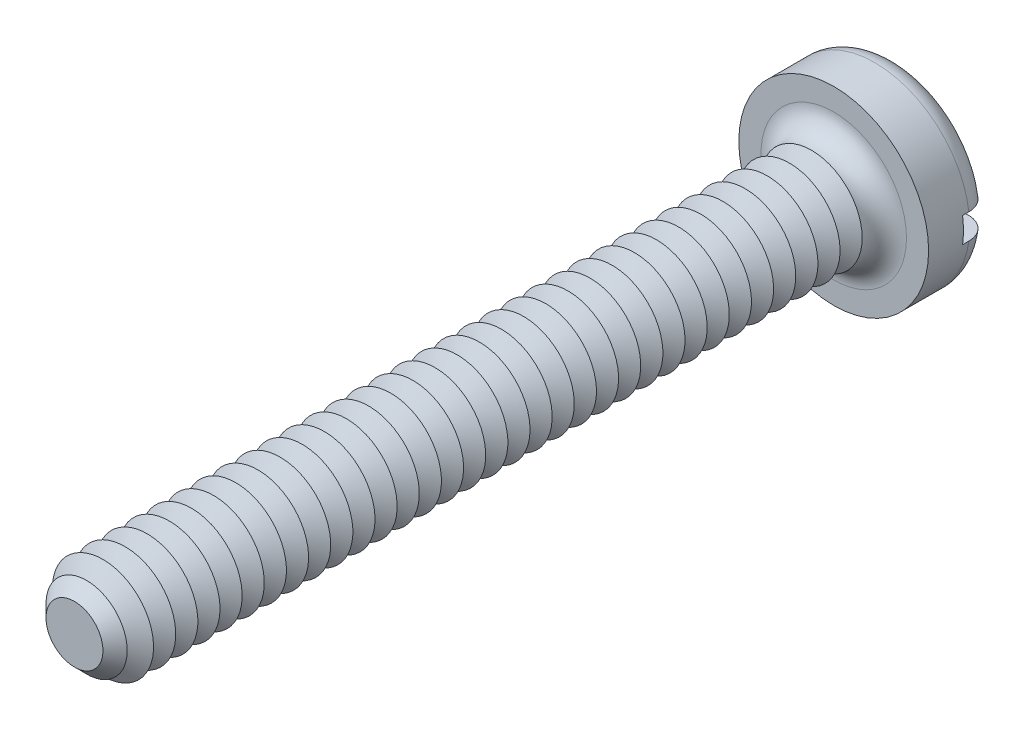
SolidWorks part; units mm, degrees
ref_plane "Front Plane" through (0, 0, 0) normal (0, 0, 1) x (1, 0, 0)
ref_plane "Top Plane" through (0, 0, 0) normal (0, 1, 0) x (1, 0, 0)
ref_plane "Right Plane" through (0, 0, 0) normal (1, 0, 0) x (0, 0, -1)
sketch "Sketch3" plane through (0, 0, 0) normal (0, 0, 1) x (1, 0, 0)
  circle A0 centre (0, 0) radius 1.5
  dimension "D1" = 3
extrude "Boss-Extrude2" add sketch "Sketch3" against normal blind 1
sketch "Sketch4" plane through (0, 0, 0) normal (0, 0, 1) x (1, 0, 0)
  circle A0 centre (0, 0) radius 0.8
  dimension "D1" = 1.6
extrude "Boss-Extrude3" add sketch "Sketch4" along normal blind 12
fillet "Fillet1" radius 0.35 2 edges at (1.5, 0, -1) (0.8, 0, 0)
chamfer "Chamfer1" distance 0.35 angle 45 1 edges at (0.8, 0, 12)
sketch "Sketch5" plane through (0, 0, 0) normal (1, 0, 0) x (0, 0, -1)
  line L0 (1.6944, 0) -> (-7.6738, 0) construction
sketch "Sketch6" plane through (0, 0, 0) normal (1, 0, 0) x (0, 0, -1)
  line L0 (-0.35, 0.8) -> (-0.525, 0.4969)
  line L1 (-0.525, 0.4969) -> (-0.7, 0.8)
  line L2 (-0.35, 0.8) -> (-11.65, 0.8) construction
  line L3 (-0.7, 0.8) -> (-0.35, 0.8)
  dimension "D1" = 0.35
revolve "Cut-Revolve1" cut sketch "Sketch6" angle 360 about L0
pattern_linear "LPattern1" count 33 spacing 0.35 along (0, 0, 1) of "Cut-Revolve1"
sketch "Sketch8" plane through (0, 0, -1) normal (0, 0, -1) x (-1, 0, 0)
  line L1 (1.5, -0.2) -> (-1.5, -0.2)
  line L2 (1.5, -0.2) -> (1.5, 0.2)
  line L3 (1.5, 0.2) -> (-1.5, 0.2)
  line L4 (-1.5, -0.2) -> (-1.5, 0.2)
  line L5 (1.5, -0.2) -> (-1.5, 0.2) construction
  line L6 (1.5, 0.2) -> (-1.5, -0.2) construction
  point P0 (0, 0)
  dimension "D1" = 3
  dimension "D2" = 0.4
extrude "Cut-Extrude1" cut sketch "Sketch8" against normal blind 0.45
